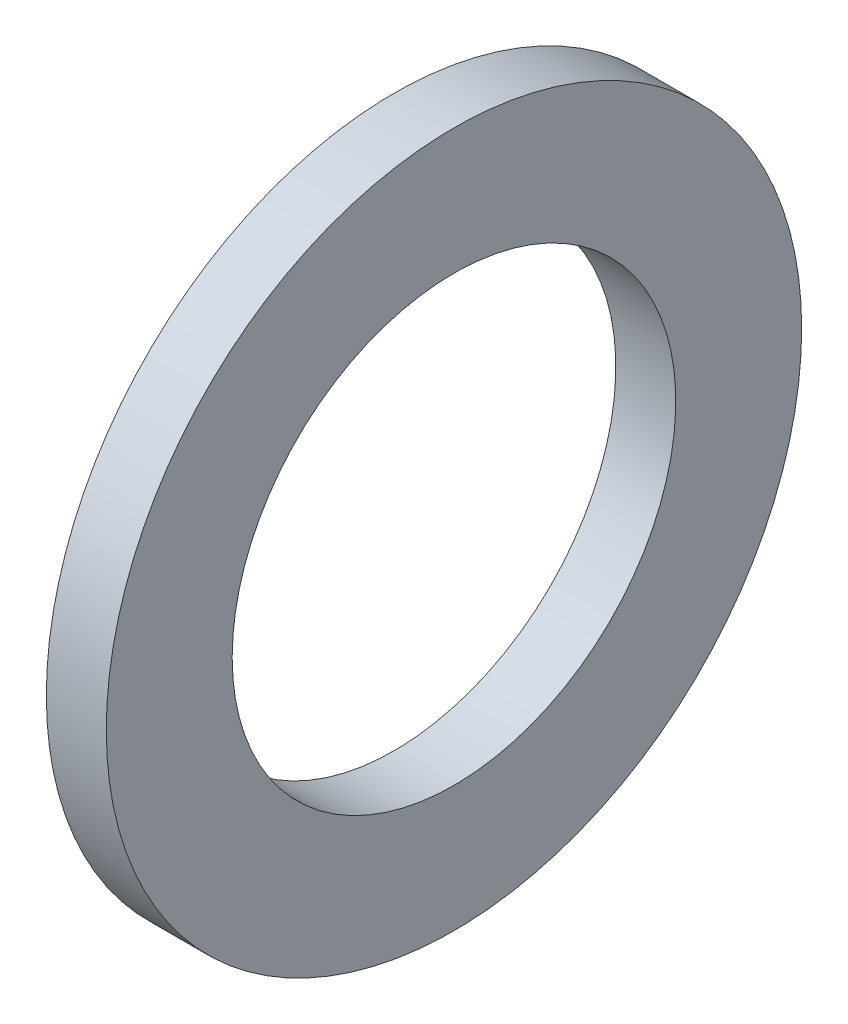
SolidWorks part; units mm, degrees
ref_plane "Plane1" through (0, 0, 0) normal (0, 0, 1) x (1, 0, 0)
ref_plane "Plane2" through (0, 0, 0) normal (0, 1, 0) x (1, 0, 0)
ref_plane "Plane3" through (0, 0, 0) normal (1, 0, 0) x (0, 0, -1)
other "Configuration Table"
sketch "Sketch1" plane through (0, 0, 0) normal (0, 0, 1) x (1, 0, 0)
  line L0 (-34.925, 0) -> (9.525, 0) construction
  line L1 (0, 18.5) -> (0, 29)
  line L2 (0, 29) -> (-5, 29)
  line L3 (-5, 29) -> (-5, 18.5)
  line L4 (-5, 18.5) -> (0, 18.5)
  dimension "Thickness" = 5
  dimension "Inside_dia" = 37
  dimension "Outside_dia" = 58
revolve "Base-Revolve" add sketch "Sketch1" angle 360 about L0
